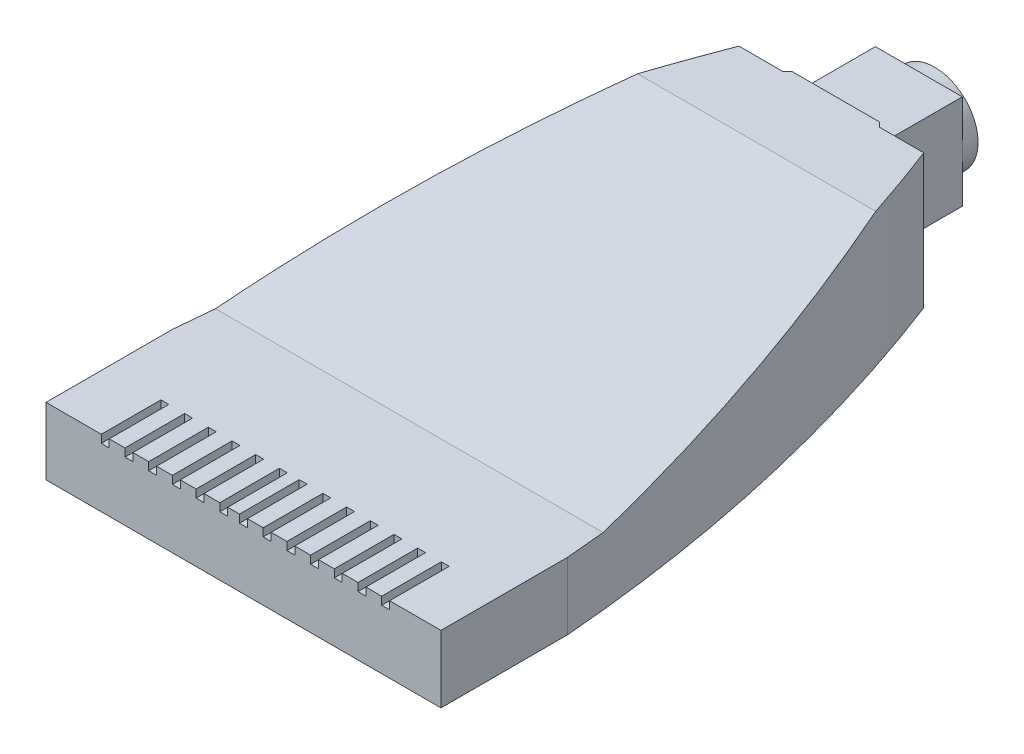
SolidWorks part; units mm, degrees
ref_plane "Front Plane" through (0, 0, 0) normal (0, 0, 1) x (1, 0, 0)
ref_plane "Top Plane" through (0, 0, 0) normal (0, 1, 0) x (1, 0, 0)
ref_plane "Right Plane" through (0, 0, 0) normal (1, 0, 0) x (0, 0, -1)
sketch "Schizzo1" plane through (0, 0, 0) normal (0, 1, 0) x (1, 0, 0)
  line L0 (-25.5, -23.9407) -> (24.5, -23.9407)
  line L1 (-0.5, -23.9407) -> (-0.5, 51.0593)
  line L2 (-0.5, 91.0608) -> (-0.5, -50.8296) construction
  line L3 (-6, 51.0593) -> (5, 51.0593)
  line L4 (-6, 51.0593) -> (-6, 61.5593)
  line L5 (-6, 61.5593) -> (5, 61.5593)
  line L6 (5, 61.5593) -> (5, 51.0593)
  line L7 (-25.5, -23.9407) -> (-25.5, -7.9407)
  line L8 (24.5, -23.9407) -> (24.5, -7.9407)
  line L9 (-12.1947, 50.4823) -> (11.1947, 50.4823)
  line L10 (-6, 51.0593) -> (-6.577, 50.4823)
  line L11 (5, 51.0593) -> (5.577, 50.4823)
  spline S0 degree 2 poles (-25.5, -7.9407) (-23.065, 22.2268) (-12.1947, 50.4823) knots 0 0 0 1 1 1
  spline S1 degree 2 poles (24.5, -7.9407) (22.065, 22.2268) (11.1947, 50.4823) knots 0 0 0 1 1 1
  dimension "D1" = 50
  dimension "D2" = 10.5
  dimension "D3" = 75
  dimension "D5" = 0
  dimension "D6" = 11
  dimension "D8" = 16
extrude "Estrusione-Estrusione1" add sketch "Schizzo1" along normal blind 17
sketch "Schizzo3" plane through (24.5, 0, 0) normal (1, 0, 0) x (0, 0, -1)
  line L0 (-23.9407, 8.5) -> (-7.9407, 8.5)
  line L1 (-23.9407, 17) -> (-23.9407, 0) construction
  line L2 (-7.9407, 17) -> (-7.9407, 0) construction
  line L3 (-7.9407, 8.5) -> (-2.9415, 8.5)
  line L4 (-2.9415, 8.5) -> (41.0271, 17)
  line L5 (50.4823, 17) -> (-7.9407, 17) construction
  line L6 (41.0271, 17) -> (50.4823, 17)
  line L7 (41.0271, 17) -> (-23.9407, 17)
  line L8 (-23.9407, 17) -> (-23.9407, 8.5)
sketch "Schizzo8" plane through (5, 0, 0) normal (1, 0, 0) x (0, 0, -1)
  line L0 (51.0593, 17) -> (51.0593, 0) construction
  line L1 (61.5593, 17) -> (51.0593, 17)
  line L2 (61.5593, 17) -> (61.5593, 14.5)
  line L3 (61.5593, 14.5) -> (51.0593, 14.5)
  line L4 (51.0593, 17) -> (51.0593, 14.5)
  line L5 (61.5593, 0) -> (51.0593, 0)
  line L6 (51.0593, 0) -> (51.0593, 2.5)
  line L7 (51.0593, 2.5) -> (61.5593, 2.5)
  line L8 (61.5593, 17) -> (61.5593, 0) construction
  line L9 (61.5593, 2.5) -> (61.5593, 0)
  dimension "D1" = 12
  dimension "D2" = 2.5
extrude "Taglio-Estrusione4" cut sketch "Schizzo8" against normal blind 11
sketch "Schizzo9" plane through (0, 0, -61.5593) normal (0, 0, -1) x (-1, 0, 0)
  line L2 (6, 14.5) -> (6, 2.5) construction
  circle A0 centre (0.5, 8.4972) radius 5.5
  dimension "D1" = 11
  dimension "D2" = 5.5
extrude "Estrusione-Estrusione3" add sketch "Schizzo9" along normal blind 2
extrude "Taglio-Estrusione2" cut sketch "Schizzo3" against normal blind 80 contours L4 L7 L3 M2 | L0 M4 M2 M3
mirror "Specchia1" about plane through (0, 17, 0) normal (0, 1, 0)
sketch "Schizzo7" plane through (0, 34, 0) normal (0, 1, 0) x (1, 0, 0)
  line L1 (-78.8617, 105.2619) -> (110.2688, 105.2619) construction
  line L2 (-78.8617, 105.2619) -> (-78.8617, -67.7065) construction
  line L3 (-78.8617, -67.7065) -> (110.2688, -67.7065) construction
  line L4 (110.2688, 105.2619) -> (110.2688, -67.7065) construction
extrude "Taglio-Estrusione3" cut sketch "Schizzo7" against normal blind 17
sketch "Schizzo10" plane through (0, 8.5, 0) normal (0, 1, 0) x (1, 0, 0)
  line L0 (-25.5, -23.9407) -> (24.5, -23.9407) construction
  line L1 (-20.5, -23.9407) -> (19.5, -23.9407)
  line L2 (-20.5, -23.9407) -> (-20.5, -16.3904)
  line L3 (-20.5, -16.3904) -> (19.5, -16.3904)
  line L4 (19.5, -23.9407) -> (19.5, -16.3904)
  line L5 (24.5, -23.9407) -> (24.5, -7.9407) construction
  line L7 (-25.5, -7.9407) -> (-25.5, -23.9407) construction
  line L8 (-18.5, -23.9407) -> (-18.5, -16.3904)
  line L9 (-17.5, -23.9407) -> (-17.5, -16.3904)
  line L10 (-15.5, -23.9407) -> (-15.5, -16.3904)
  line L11 (-14.5, -23.9407) -> (-14.5, -16.3904)
  line L12 (-12.5, -23.9407) -> (-12.5, -16.3904)
  line L13 (-11.5, -23.9407) -> (-11.5, -16.3904)
  line L14 (-9.5, -23.9407) -> (-9.5, -16.3904)
  line L15 (-8.5, -23.9407) -> (-8.5, -16.3904)
  line L16 (-6.5, -23.9407) -> (-6.5, -16.3904)
  line L17 (-5.5, -23.9407) -> (-5.5, -16.3904)
  line L18 (-3.5, -23.9407) -> (-3.5, -16.3904)
  line L19 (-2.5, -16.3904) -> (-2.5, -23.9407)
  line L20 (2, -16.3904) -> (2, -23.9407)
  line L21 (3, -23.9407) -> (3, -16.3904)
  line L22 (5, -23.9407) -> (5, -16.3904)
  line L23 (6, -23.9407) -> (6, -16.3904)
  line L24 (8, -23.9407) -> (8, -16.3904)
  line L25 (9, -23.9407) -> (9, -16.3904)
  line L26 (11, -23.9407) -> (11, -16.3904)
  line L27 (12, -23.9407) -> (12, -16.3904)
  line L28 (14, -23.9407) -> (14, -16.3904)
  line L29 (15, -23.9407) -> (15, -16.3904)
  line L30 (17, -23.9407) -> (17, -16.3904)
  line L31 (18, -23.9407) -> (18, -16.3904)
  line L32 (-1, -23.9407) -> (-1, -16.3904)
  line L33 (0, -23.9407) -> (0, -16.3904)
  line L35 (-0.5, -11.2715) -> (-0.5, -30.1696) construction
  dimension "D1" = 5
  dimension "D2" = 5
  dimension "D3" = 2
  dimension "D4" = 1
  dimension "D5" = 2
  dimension "D6" = 1
  dimension "D7" = 2
  dimension "D8" = 1
  dimension "D9" = 2
  dimension "D10" = 1
  dimension "D11" = 2
  dimension "D12" = 1
  dimension "D13" = 2
  dimension "D14" = 1
  dimension "D15" = 25
  dimension "D16" = 1
extrude "Taglio-Estrusione5" cut sketch "Schizzo10" against normal blind 1 contours L1 L9 L3 L8 | L1 L11 L3 L10 | L1 L13 L3 L12 | L1 L15 L3 L14 | L1 L17 L3 L16 | L19 L3 L18 L1 | L35 L3 L32 L1 | L3 L35 L33 M3 | L1 L21 L3 L20 | L1 L23 L3 L22 | L1 L25 L3 L24 | L1 L27 L3 L26 | L1 L29 L3 L28 | L1 L31 L3 L30
